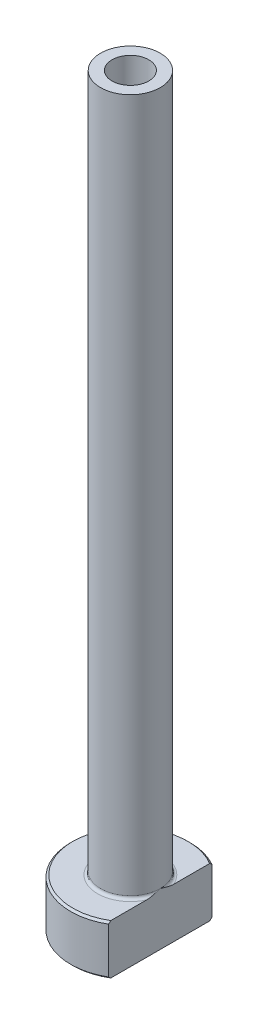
SolidWorks part; units mm, degrees
ref_plane "Front Plane" through (0, 0, 0) normal (0, 0, 1) x (1, 0, 0)
ref_plane "Top Plane" through (0, 0, 0) normal (0, 1, 0) x (1, 0, 0)
ref_plane "Right Plane" through (0, 0, 0) normal (1, 0, 0) x (0, 0, -1)
sketch "Sketch1" plane through (0, 0, 0) normal (0, 0, 1) x (1, 0, 0)
  line L0 (-1.85, 75) -> (-3, 75)
  line L1 (-3, 75) -> (-3, 5)
  line L2 (-3, 5) -> (-6, 5)
  line L3 (-6, 5) -> (-6, 0)
  line L4 (4.95, 0) -> (-4.95, 0) construction
  line L5 (-6, 0) -> (-2.1, 0)
  line L6 (-1.85, 30) -> (-1.85, 75)
  line L7 (0, 92.1877) -> (0, -15.5353) construction
  line L8 (0, -6.6) -> (0, 6.6) construction
  line L9 (-1.85, 30) -> (-2.1, 18)
  line L10 (-2.1, 18) -> (-2.1, 0)
  dimension "D1" = 0.25
  dimension "ID" = 3.7
  dimension "OD" = 6
  dimension "L" = 75
  dimension "H" = 12
  dimension "T" = 5
  dimension "N" = 45
  dimension "D2" = 12
  dimension "L-N" = 30
revolve "Revolve1" add sketch "Sketch1" angle 360 about L7
fillet "Fillet1" radius 0.3 1 edges at (0, 5, 3)
chamfer "Chamfer1" distance 0.2 angle 45 2 edges at (0, 5, 6) (0, 0, 6)
sketch "Sketch2" plane through (0, 0, 0) normal (0, -1, 0) x (1, 0, 0)
  line L0 (3, 5.1962) -> (3, -5.1962)
  circle A0 centre (0, 0) radius 6 construction
  arc A1 (3, 5.1962) -> (3, -5.1962) centre (0, 0) cw
  circle A2 centre (0, 0) radius 3 construction
extrude "Cut-Extrude1" cut sketch "Sketch2" against normal through all
chamfer "Chamfer2" distance 0.5 angle 45 1 edges at (0, 0, 2.1)
